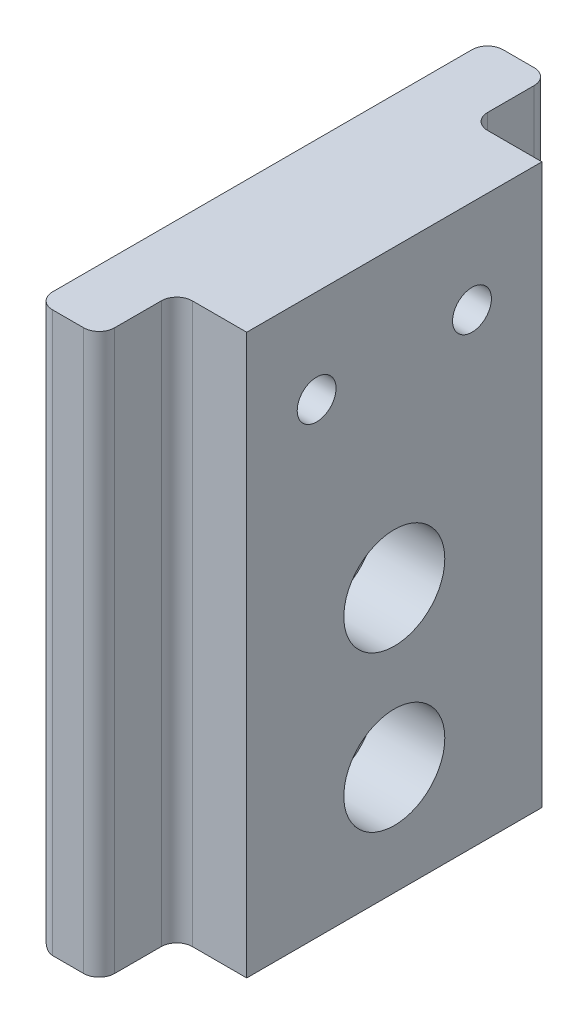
SolidWorks part; units mm, degrees
ref_plane "Front Plane" through (0, 0, 0) normal (0, 0, 1) x (1, 0, 0)
ref_plane "Top Plane" through (0, 0, 0) normal (0, 1, 0) x (1, 0, 0)
ref_plane "Right Plane" through (0, 0, 0) normal (1, 0, 0) x (0, 0, -1)
body saved out of another part "Stock-zeiss_mount_bracket_3 - v3-1"
